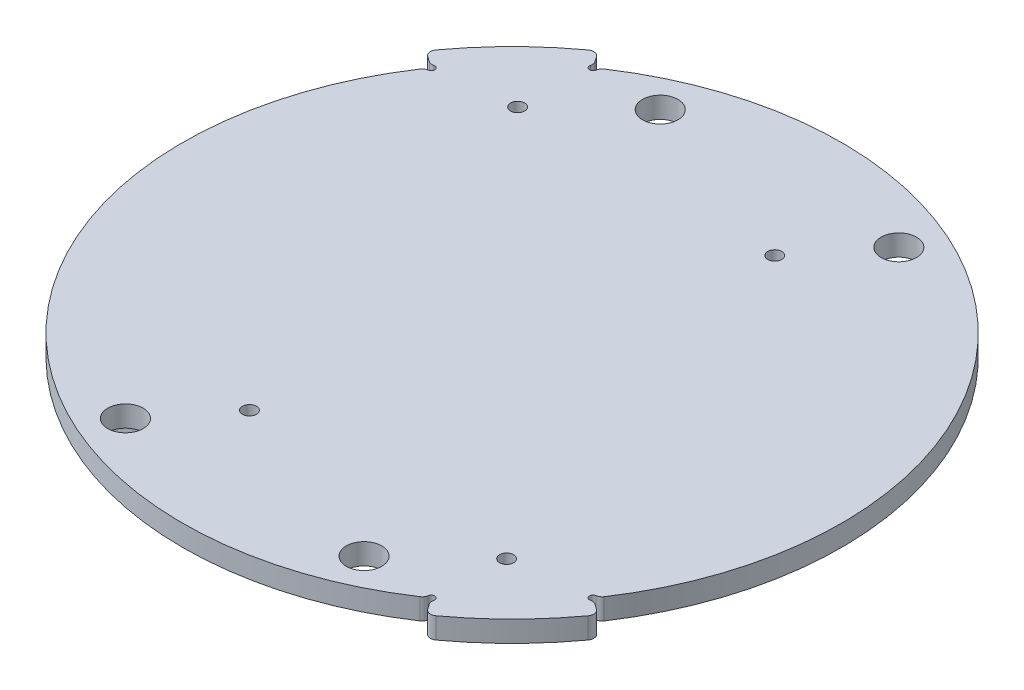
SolidWorks part; units mm, degrees
other "<a_base>-<Holes Pattern>"
ref_plane "Front Plane" through (0, 0, 0) normal (0, 0, 1) x (1, 0, 0)
ref_plane "Top Plane" through (0, 0, 0) normal (0, 1, 0) x (1, 0, 0)
ref_plane "Right Plane" through (0, 0, 0) normal (1, 0, 0) x (0, 0, -1)
inserted part "a_base"
sketch "Sketch1" plane through (0, -1.5, 0) normal (0, -1, 0) x (1, 0, 0)
  line L0 (27.5, 28.2843) -> (-9.1667, 28.2843) construction
  line L1 (9.1667, -28.2843) -> (-27.5, -28.2843) construction
  line L2 (9.1667, 28.2843) -> (-9.1667, -28.2843) construction
  line L3 (0, 0) -> (-44.7105, 14.4903) construction
  line L4 (0.1764, 16.7621) -> (-7.4339, 19.2286)
  line L5 (-7.4339, 19.2286) -> (-17.2996, -11.2127)
  line L6 (1.1013, 19.616) -> (-35.0366, 31.3279)
  line L7 (-20.1535, -10.2878) -> (-10.2878, 20.1535)
  line L8 (-10.2878, 20.1535) -> (-26.4596, 25.3946)
  line L9 (-26.4596, 25.3946) -> (-36.3254, -5.0466)
  line L10 (-39.1792, -4.1217) -> (-29.3135, 26.3195)
  line L11 (-29.3135, 26.3195) -> (-37.1072, 28.8454)
  line L12 (-7.4339, 19.2286) -> (-10.2878, 20.1535) construction
  line L13 (-26.4596, 25.3946) -> (-29.3135, 26.3195) construction
  line L14 (1.1013, 19.616) -> (0.1764, 16.7621)
  line L15 (-39.1792, -4.1217) -> (-46.9729, -1.5958)
  line L16 (-20.1535, -10.2878) -> (-36.3254, -5.0466)
  line L17 (-9.6893, -13.6791) -> (-17.2996, -11.2127)
  line L18 (-10.6142, -16.533) -> (-46.7521, -4.821)
  line L19 (-10.6142, -16.533) -> (-9.6893, -13.6791)
  circle A0 centre (0, 0) radius 47 construction
  arc A1 (-35.0366, 31.3279) -> (-37.1072, 28.8454) centre (0, 0) ccw
  arc A2 (-46.7521, -4.821) -> (-46.9729, -1.5958) centre (0, 0) cw
  point P30 (-34.2464, 11.0989)
  point P31 (-31.3925, 10.174)
  point P32 (-15.2206, 4.9329)
  point P33 (-12.3667, 4.0079)
  dimension "D1" = 3
  dimension "D2" = 16
  dimension "D3" = 23
  dimension "D4" = 36
  dimension "D5" = 8
extrude "Servo Standoff" add sketch "Sketch1" along normal blind 8 contours L18 L19 L17 L5 L4 L14 L6 L11 L10 L15 L7 L16 L9 L8 M12
sketch "Sketch3" plane through (5.8578, 0, 18.0745) normal (0.3083, 0, 0.9513) x (0.9513, 0, -0.3083)
  line L0 (-5, -1.5) -> (-5, -9.5)
  line L1 (-5, -9.5) -> (-13, -9.5)
  line L3 (-5, -9.5) -> (-42.9884, -9.5) construction
  line L4 (-36, -9.5) -> (-44.1928, -9.5)
  line L6 (-44, -1.5) -> (-44.1928, -1.5)
  line L7 (-44.1928, -1.5) -> (-44.1928, -9.5)
  line L8 (-5, -1.5) -> (-42.9884, -1.5) construction
  arc A0 (-5, -1.5) -> (-13, -9.5) centre (-5, -9.5) ccw
  arc A1 (-36, -9.5) -> (-44, -1.5) centre (-44, -9.5) ccw
  dimension "D1" = 23
extrude "Servo Standoff Side Cut" cut sketch "Sketch3" against normal through all
sketch "Sketch2" plane through (0, -1.5, 0) normal (0, -1, 0) x (1, 0, 0)
  line L0 (0, 0) -> (-12.3667, 4.0079) construction
  line L1 (-7.4339, 19.2286) -> (-17.2996, -11.2127) construction
  line L2 (-6.7823, 7.4541) -> (9.8653, 2.0588)
  line L3 (9.8653, 2.0588) -> (6.7823, -7.4541)
  line L4 (6.7823, -7.4541) -> (-9.8653, -2.0588)
  line L5 (-6.7823, 7.4541) -> (-9.8653, -2.0588)
  line L6 (0, 0) -> (-14.4903, -44.7105) construction
  line L7 (14.8332, 3.6024) -> (-9.9003, 11.6183)
  line L8 (-9.9003, 11.6183) -> (-14.8332, -3.6024)
  line L9 (-14.8332, -3.6024) -> (9.9003, -11.6183)
  line L10 (9.9003, -11.6183) -> (14.8332, 3.6024)
  arc A0 (-46.7521, -4.821) -> (-35.0366, 31.3279) centre (0, 0) ccw construction
  dimension "D1" = 10
  dimension "D2" = 17.5
  dimension "D3" = 3
extrude "Servo Top" add sketch "Sketch2" along normal blind 5
sketch "Sketch7" plane through (2.4664, 0, 7.6103) normal (0.3083, 0, 0.9513) x (0.9513, 0, -0.3083)
  line L0 (0, -1.5) -> (0, -6.5) construction
  line L1 (13, -1.5) -> (-13, -1.5) construction
  line L2 (-13, -6.5) -> (13, -6.5) construction
  line L3 (-13, -3.5) -> (0, -3.5)
  line L4 (-13, -6.5) -> (-13, -1.5) construction
  line L5 (-13, -3.5) -> (-13, -6.5)
  line L6 (0, -4) -> (13, -4) construction
  line L7 (13, -6.5) -> (13, -1.5) construction
  line L8 (6.5, -4) -> (6.5, -6.5) construction
  line L9 (-13, -6.5) -> (6.5, -6.5)
  arc A0 (0, -3.5) -> (6.5, -6.5) centre (0, -12.0417) cw
  dimension "D1" = 2
extrude "Servo Top Side Cut" cut sketch "Sketch7" against normal up to surface (16 mm away)
sketch "Sketch10" plane through (0, -9.5, 0) normal (0, -1, 0) x (1, 0, 0)
  line L0 (-6.509, 22.0824) -> (-28.3886, 29.1734)
  line L1 (-28.3886, 29.1734) -> (-29.3135, 26.3195)
  line L2 (-29.3135, 26.3195) -> (-7.4339, 19.2286)
  line L3 (-7.4339, 19.2286) -> (-6.509, 22.0824)
  line L4 (-18.2245, -14.0665) -> (-40.1041, -6.9755)
  line L5 (-40.1041, -6.9755) -> (-39.1792, -4.1217)
  line L6 (-39.1792, -4.1217) -> (-17.2996, -11.2127)
  line L7 (-17.2996, -11.2127) -> (-18.2245, -14.0665)
extrude "Servo Standoff Legs" add sketch "Sketch10" along normal blind 3
sketch "Sketch12" plane through (0, 1.5, 0) normal (0, 1, 0) x (1, 0, 0)
  line L0 (0, 0) -> (47, 0) construction
  line L1 (0, 0) -> (0, -47) construction
  line L2 (0, 0) -> (33.234, -33.234) construction
  line L3 (0, 0) -> (38.5001, -26.9581) construction
  line L4 (0, 0) -> (26.9581, -38.5001) construction
  line L5 (-38.5001, 26.9581) -> (-40.9576, 28.6788)
  line L6 (38.5001, -26.9581) -> (40.9576, -28.6788)
  line L7 (26.9581, -38.5001) -> (28.6788, -40.9576)
  line L8 (0, 0) -> (33.234, 33.234) construction
  line L9 (-26.9581, 38.5001) -> (-28.6788, 40.9576)
  circle A0 centre (0, 0) radius 47 construction
  arc A1 (28.6788, -40.9576) -> (40.9576, -28.6788) centre (0, 0) ccw
  arc A2 (26.9581, -38.5001) -> (38.5001, -26.9581) centre (0, 0) ccw
  arc A3 (-38.5001, 26.9581) -> (-26.9581, 38.5001) centre (0, 0) cw
  arc A4 (-40.9576, 28.6788) -> (-28.6788, 40.9576) centre (0, 0) cw
  dimension "D1" = 45
  dimension "D2" = 20
  dimension "D3" = 3
extrude "Positioning Extrude" add sketch "Sketch12" against normal up to surface (3 mm away) contours L7 A1 L6 M11 | A4 L5 L9 M11
hole_wizard "#8 (0.199) Diameter Hole1" positions "Sketch14" profile "Sketch13" hole size "#8" standard "ANSI Inch"
sketch "Sketch14" plane through (0, 1.5, 0) normal (0, 1, 0) x (1, 0, 0)
  point P0 (-17.0093, -38.128)
  point P3 (17.0093, -38.128)
  point P6 (17.0093, 38.128)
  point P9 (-17.0093, 38.128)
sketch "Sketch13" plane through (-17.0093, 1.5, 38.128) normal (1, 0, 0) x (0, 0, 1)
  line L0 (0, 0) -> (0, 11.5186)
  line L1 (0, 11.5186) -> (2.5273, 10)
  line L2 (2.5273, 10) -> (2.5273, 0)
  line L5 (2.5273, 0) -> (0, 0)
  line L10 (0, 11.5186) -> (-2.5273, 10) construction
  line L11 (0, -6.35) -> (0, 107.95) construction
  dimension "Hole Dia." = 5.0546
  dimension "Hole Depth" = 10
  dimension "Drill Angle" = 118
sketch "Sketch8" plane through (0, -6.5, 0) normal (0, -1, 0) x (1, 0, 0)
  circle A0 centre (9.8653, 2.0588) radius 0.5
  circle A1 centre (6.7823, -7.4541) radius 0.5
  circle A2 centre (-6.7823, 7.4541) radius 0.5
  circle A3 centre (-9.8653, -2.0588) radius 0.5
  dimension "D1" = 1
extrude "Allowance Holes 1" cut sketch "Sketch8" against normal up to surface (5 mm away)
sketch "Sketch15" plane through (0, -1.5, 0) normal (0, -1, 0) x (1, 0, 0)
  circle A0 centre (38.5001, 26.9581) radius 0.5
  circle A1 centre (26.9581, 38.5001) radius 0.5
  circle A2 centre (-38.5001, -26.9581) radius 0.5
  circle A3 centre (-26.9581, -38.5001) radius 0.5
  dimension "D1" = 1
extrude "Allowance Holes 2" cut sketch "Sketch15" against normal through all
fillet "Allowance Fillets" radius 1 26 edges at (9.9003, -4, -11.6183) (14.8332, -4, 3.6024) (8.1873, -6.5, 4.1794) (4.1794, -6.5, -8.1873) (28.6788, 0, 40.9576) (40.9576, 0, 28.6788) (-28.6788, 0, -40.9576) (-40.9576, 0, -28.6788) (9.7111, -4, 1.5831) (9.3896, -4, 2.2129) (6.3066, -4, -7.2999) (6.9364, -4, -6.9785) (-6.9364, -2.5, 6.9785) (-6.3066, -2.5, 7.2999) (-9.7111, -2.5, -1.5831) (-9.3896, -2.5, -2.2129) (38.9097, 0, 27.2449) (38.7848, 0, 26.547) (27.2449, 0, 38.9097) (26.547, 0, 38.7848) (-38.9097, 0, -27.2449) (-38.7848, 0, -26.547) (-27.2449, 0, -38.9097) (-26.547, 0, -38.7848)
ref_point "Ref Center"
equation "\"D1@Sketch1\"=\"width keep@values@params.sldprt\""
equation "\"D3@Sketch2\"=\"width keep@values@params.sldprt\""
equation "\"D3@Sketch12\" = \"width keep@values@params.sldprt\""
equation "\"D1@Sketch16\" = \"print fit@values@params.sldprt\""
